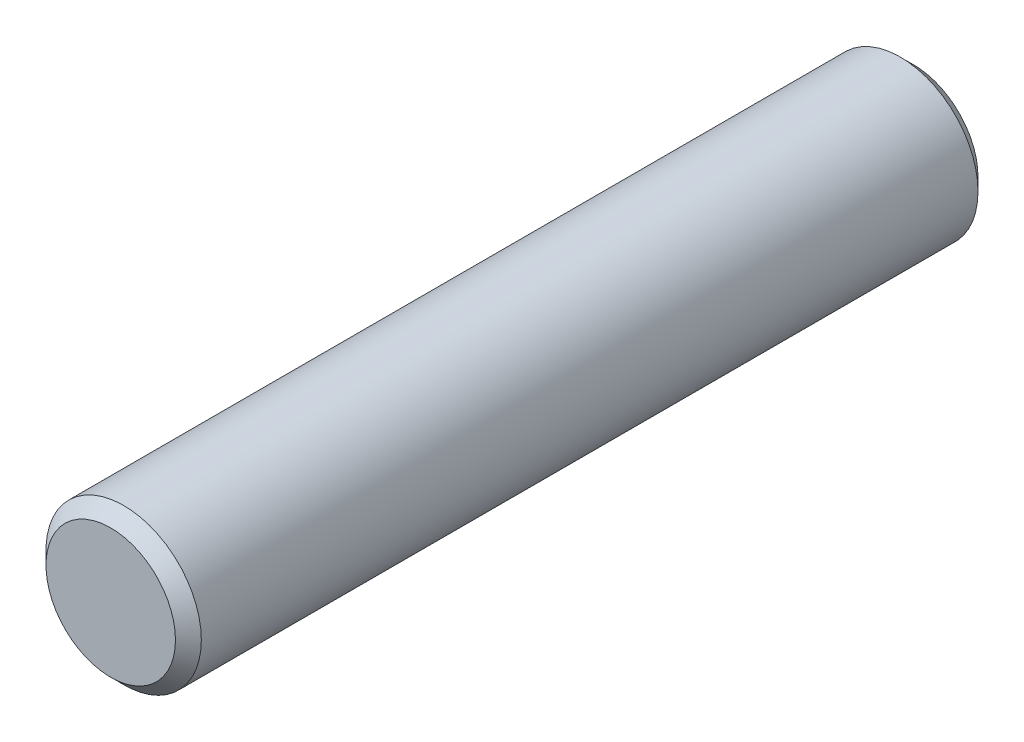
SolidWorks part; units mm, degrees
ref_plane "Plan de face" through (0, 0, 0) normal (0, 0, 1) x (1, 0, 0)
ref_plane "Plan de dessus" through (0, 0, 0) normal (0, 1, 0) x (1, 0, 0)
ref_plane "Plan de droite" through (0, 0, 0) normal (1, 0, 0) x (0, 0, -1)
sketch "Esquisse1" plane through (0, 0, 0) normal (0, 0, 1) x (1, 0, 0)
  circle A0 centre (0, 0) radius 3
  dimension "D1" = 6
extrude "Extrusion1" add sketch "Esquisse1" along normal blind 31
chamfer "Chanfrein1" distance 0.5 angle 45 2 edges at (3, 0, 0) (3, 0, 31)
